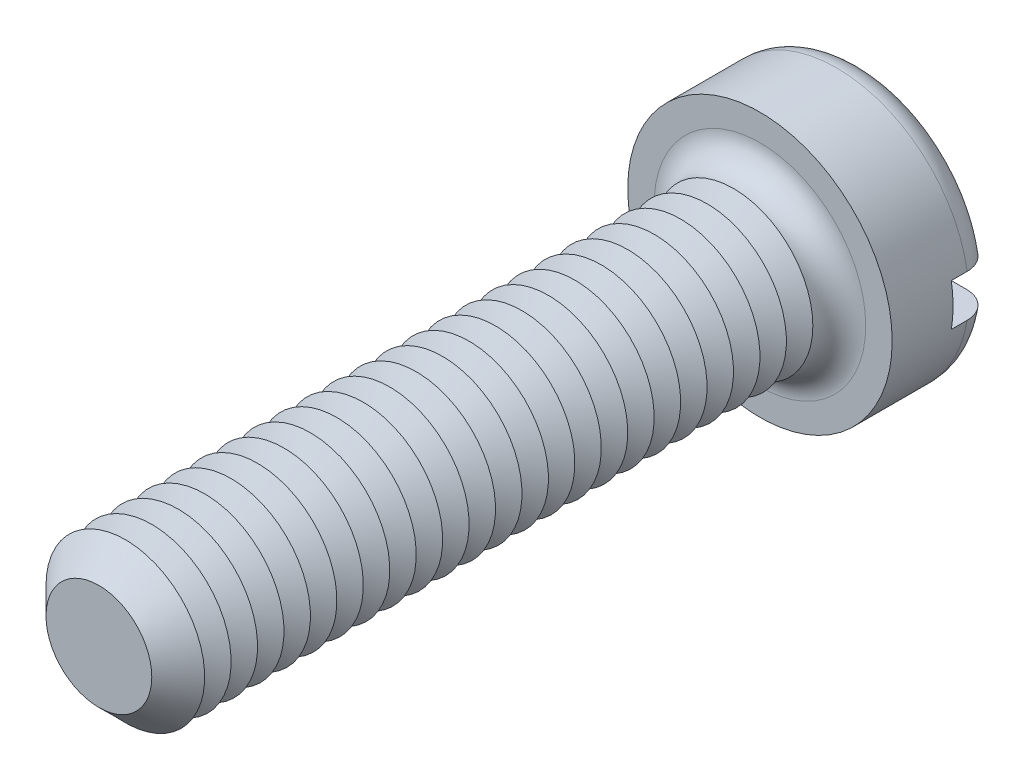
SolidWorks part; units mm, degrees
ref_plane "Front Plane" through (0, 0, 0) normal (0, 0, 1) x (1, 0, 0)
ref_plane "Top Plane" through (0, 0, 0) normal (0, 1, 0) x (1, 0, 0)
ref_plane "Right Plane" through (0, 0, 0) normal (1, 0, 0) x (0, 0, -1)
sketch "Sketch3" plane through (0, 0, 0) normal (0, 0, 1) x (1, 0, 0)
  circle A0 centre (0, 0) radius 5
  dimension "D1" = 10
extrude "Boss-Extrude2" add sketch "Sketch3" against normal blind 3.9
sketch "Sketch4" plane through (0, 0, 0) normal (0, 0, 1) x (1, 0, 0)
  circle A0 centre (0, 0) radius 3
  dimension "D1" = 6
extrude "Boss-Extrude3" add sketch "Sketch4" along normal blind 25
fillet "Fillet1" radius 1 2 edges at (5, 0, -3.9) (3, 0, 0)
chamfer "Chamfer1" distance 1 angle 45 1 edges at (3, 0, 25)
sketch "Sketch5" plane through (0, 0, 0) normal (1, 0, 0) x (0, 0, -1)
  line L0 (1.6944, 0) -> (-7.6738, 0) construction
sketch "Sketch6" plane through (0, 0, 0) normal (1, 0, 0) x (0, 0, -1)
  line L0 (-1, 3) -> (-1.5, 2.134)
  line L1 (-1.5, 2.134) -> (-2, 3)
  line L2 (-1, 3) -> (-24, 3) construction
  line L3 (-2, 3) -> (-1, 3)
  dimension "D1" = 1
revolve "Cut-Revolve1" cut sketch "Sketch6" angle 360 about L0
pattern_linear "LPattern1" count 23 spacing 1 along (0, 0, 1) of "Cut-Revolve1"
sketch "Sketch8" plane through (0, 0, -3.9) normal (0, 0, -1) x (-1, 0, 0)
  line L1 (5, -0.8) -> (-5, -0.8)
  line L2 (5, -0.8) -> (5, 0.8)
  line L3 (5, 0.8) -> (-5, 0.8)
  line L4 (-5, -0.8) -> (-5, 0.8)
  line L5 (5, -0.8) -> (-5, 0.8) construction
  line L6 (5, 0.8) -> (-5, -0.8) construction
  point P0 (0, 0)
  dimension "D1" = 10
  dimension "D2" = 1.6
extrude "Cut-Extrude1" cut sketch "Sketch8" against normal blind 1.6
